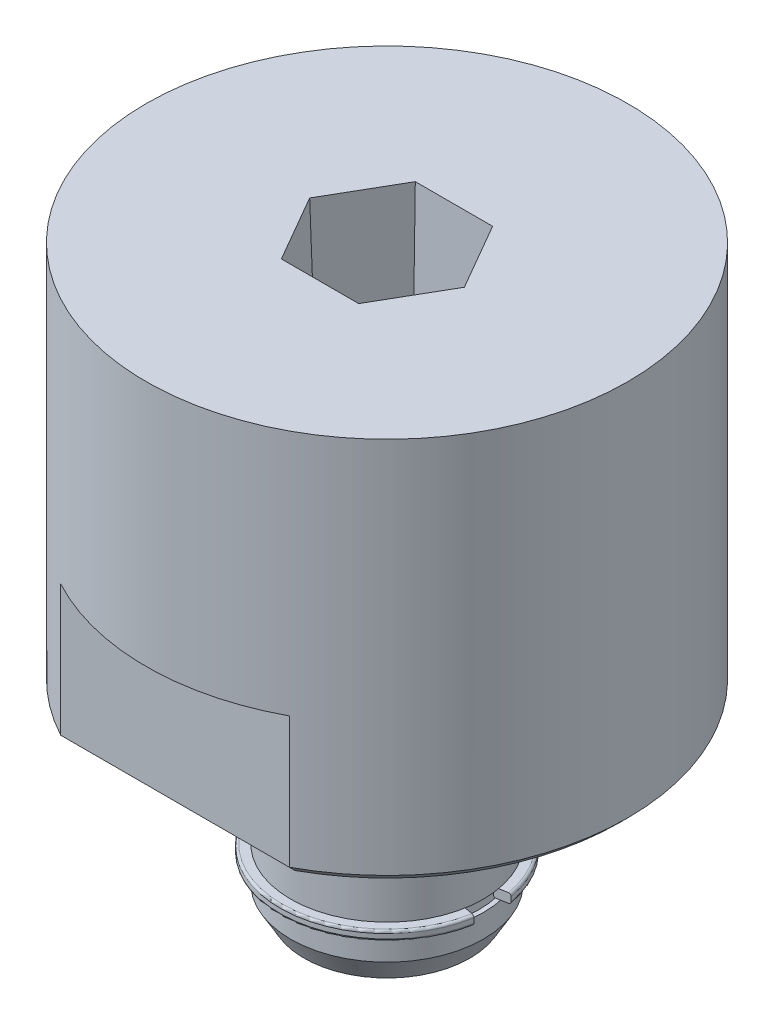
SolidWorks part; units mm, degrees
ref_plane "Front Plane" through (0, 0, 0) normal (0, 0, 1) x (1, 0, 0)
ref_plane "Top Plane" through (0, 0, 0) normal (0, 1, 0) x (1, 0, 0)
ref_plane "Right Plane" through (0, 0, 0) normal (1, 0, 0) x (0, 0, -1)
sketch "Sketch1" plane through (0, 0, 0) normal (0, 0, 1) x (1, 0, 0)
  line L0 (0, 0) -> (0, 19.05) construction
  line L1 (0, 0) -> (2.7351, 0)
  line L3 (3.683, 6.35) -> (7.935, 6.35)
  line L4 (7.935, 6.35) -> (7.935, 19.05)
  line L5 (7.935, 19.05) -> (0, 19.05)
  line L6 (0, 19.05) -> (0, 0)
  line L9 (3.175, 1.905) -> (3.0226, 1.905)
  line L10 (3.0226, 1.905) -> (3.0226, 1.524)
  line L11 (3.0226, 1.524) -> (3.175, 1.524)
  line L12 (3.175, 1.905) -> (3.175, 5.842)
  line L15 (3.175, 1.524) -> (3.175, 0.762)
  line L17 (3.175, 0.762) -> (2.7351, 0)
  arc A0 (3.175, 5.842) -> (3.683, 6.35) centre (3.683, 5.842) cw
  point P7 (0, 0)
  point P21 (3.175, 0)
  dimension "D12" = 0.508
  dimension "D2" = 6.0452
  dimension "D3" = 4.445
  dimension "D4" = 0.381
  dimension "D5" = 6.35
  dimension "D7" = 0.762
  dimension "D6" = 12.7
  dimension "D9" = 30
  dimension "D11" = 15.8699
  dimension "D8" = 6.35
revolve "Revolve1" add sketch "Sketch1" angle 360 about L0
sketch "Sketch2" plane through (0, 6.35, 0) normal (0, -1, 0) x (1, 0, 0)
  line L0 (-3.7648, 6.985) -> (3.7648, 6.985)
  line L1 (-3.7648, -6.985) -> (3.7648, -6.985)
  line L2 (-7.935, 0) -> (7.935, 0) construction
  arc A0 (-3.7648, -6.985) -> (3.7648, -6.985) centre (0, 0) ccw
  circle A1 centre (0, 0) radius 7.935 construction
  arc A2 (3.7648, 6.985) -> (-3.7648, 6.985) centre (0, 0) ccw
  circle A3 centre (0, 0) radius 7.935 construction
  dimension "D1" = 13.97
extrude "Cut-Extrude1" cut sketch "Sketch2" against normal blind 4.572
sketch "Sketch5" plane through (0, 19.05, 0) normal (0, 1, 0) x (1, 0, 0)
  line L0 (-8.7285, 0) -> (8.7285, 0) construction
  line L1 (1.1457, 1.9844) -> (-1.1457, 1.9844)
  line L2 (-1.1457, 1.9844) -> (-2.2914, 0)
  line L3 (-2.2914, 0) -> (-1.1457, -1.9844)
  line L4 (-1.1457, -1.9844) -> (1.1457, -1.9844)
  line L5 (1.1457, -1.9844) -> (2.2914, 0)
  line L6 (2.2914, 0) -> (1.1457, 1.9844)
  circle A0 centre (0, 0) radius 1.9844 construction
  dimension "D1" = 3.9688
extrude "Cut-Extrude3" cut sketch "Sketch5" against normal blind 6.35
ref_plane "Plane1" through (0, 0, 0) normal (0.7071, 0, 0.7071) x (0.7071, 0, -0.7071)
sketch "Sketch3" plane through (0, 0, 0) normal (0.7071, 0, 0.7071) x (0.7071, 0, -0.7071)
  line L0 (5.715, 5.842) -> (5.715, 6.604) construction
  line L3 (6.283, 6.35) -> (5.715, 6.35)
  line L4 (-2.2771, 6.35) -> (7.935, 6.35) construction
  line L5 (5.715, 6.35) -> (5.715, 6.604)
  arc A0 (6.283, 6.35) -> (5.715, 6.604) centre (5.715, 5.842) ccw
  dimension "D2" = 0.762
  dimension "D1" = 5.715
  dimension "D3" = 0.254
revolve "Cut-Revolve1" cut sketch "Sketch3" angle 360 about L0
pattern_circular "CirPattern1" count 8 over 360 about axis through (0, 0, 0) along (0, 1, 0) of "Cut-Revolve1"
chamfer "Chamfer1" distance 0.254 angle 45 4 edges at (0, 6.35, -6.985) (-7.935, 6.35, 0) (7.935, 6.35, 0) (0, 6.35, 6.985)
draft "Draft3" type of draft neutral plane draft angle 2 faces to draft 6 parameters "D1"=2
sketch "Sketch7" plane through (0, 0, 0) normal (0, 0, 1) x (1, 0, 0)
  line L0 (-2.8379, 19.05) -> (2.8379, 19.05)
  line L1 (2.8379, 19.05) -> (2.3451, 16.2553)
  line L3 (-2.3451, 16.2553) -> (-2.8379, 19.05)
  line L4 (7.935, 19.05) -> (-7.935, 19.05) construction
  line L5 (0, 12.7) -> (0, 19.05) construction
  arc A0 (-2.3451, 16.2553) -> (2.3451, 16.2553) centre (0, 16.6687) ccw
  dimension "D1" = 4.7625
  dimension "D2" = 10
extrude "Cut-Extrude4" [suppressed] cut sketch "Sketch7" against normal mid plane 19.05
imported_body "VS-25.sldprt"
move or copy body "Body-Move/Copy3" bodies to move or copy 136 copy no translate (-12.4284, 6.5805, 4.5248) parameters "D1"=0, "D2"=0, "D3"=0
move or copy body "Body-Move/Copy2" bodies to move or copy 137 placed by mates yes parameters "D1"=0, "D2"=0, "D3"=0
